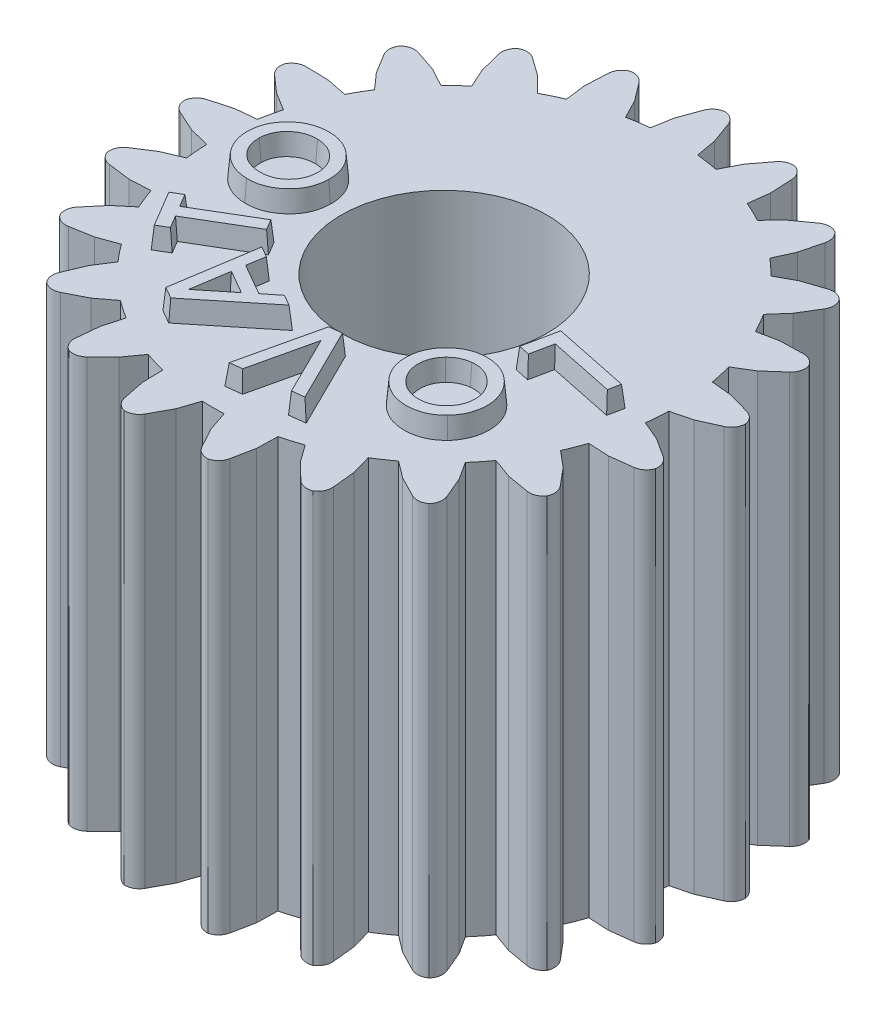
SolidWorks part; units mm, degrees
ref_plane "Front Plane" through (0, 0, 0) normal (0, 0, 1) x (1, 0, 0)
ref_plane "Top Plane" through (0, 0, 0) normal (0, 1, 0) x (1, 0, 0)
ref_plane "Right Plane" through (0, 0, 0) normal (1, 0, 0) x (0, 0, -1)
sketch "Sketch1" plane through (0, 0, 0) normal (0, 1, 0) x (1, 0, 0)
  circle A0 centre (0, 0) radius 28.575
  dimension "D1" = 57.15
extrude "Boss-Extrude1" add sketch "Sketch1" along normal blind 50.8
sketch "Sketch2" plane through (0, 50.8, 0) normal (0, 1, 0) x (1, 0, 0)
  line L0 (-2.921, 28.4253) -> (2.921, 28.4253)
  line L1 (2.921, 28.4253) -> (2.4731, 30.9653)
  line L2 (2.4731, 30.9653) -> (1.0864, 34.7753)
  line L3 (1.0864, 34.7753) -> (-1.0864, 34.7753)
  line L4 (-1.0864, 34.7753) -> (-2.4731, 30.9653)
  line L5 (-2.4731, 30.9653) -> (-2.921, 28.4253)
  circle A0 centre (0, 0) radius 28.575 construction
  dimension "D1" = 2.54
  dimension "D2" = 3.81
  dimension "D3" = 5.842
  dimension "D4" = 80
  dimension "D5" = 110
extrude "Boss-Extrude2" add sketch "Sketch2" against normal blind 50.8
fillet "Fillet1" radius 1.778 2 edges at (1.0864, 25.4, -34.7753) (-1.0864, 25.4, -34.7753)
pattern_circular "CirPattern1" count 21 over 360 about axis through (0, 0, 0) along (0, 1, 0) of "Fillet1", "Boss-Extrude2"
sketch "Sketch3" plane through (0, 50.8, 0) normal (0, 1, 0) x (1, 0, 0)
  circle A0 centre (0, 0) radius 12.7
  dimension "D1" = 25.4
extrude "Cut-Extrude1" cut sketch "Sketch3" against normal up to vertex
sketch "Sketch4" plane through (0, 50.8, 0) normal (0, 1, 0) x (1, 0, 0)
  circle A0 centre (0, 0) radius 15.875 construction
  circle A1 centre (0, 0) radius 12.7 construction
  arc A2 (-9.7016, -26.8777) -> (-7.1249, -27.6725) centre (0, 0) ccw construction
  text T0 "<b>LOVATO</b>" font "Century Gothic" height 10.16
  dimension "D1" = 12.7
  dimension "D2" = 3.175
extrude "Boss-Extrude3" add sketch "Sketch4" along normal blind 2.54 draft 5
